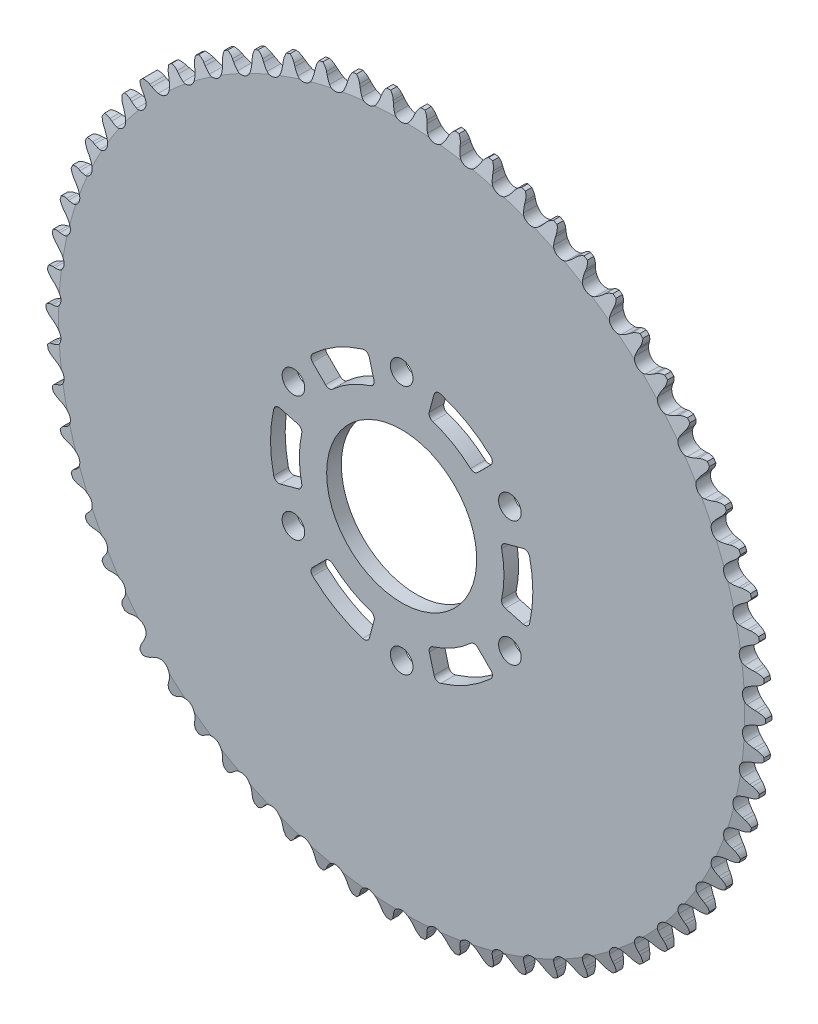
SolidWorks part; units mm, degrees
ref_plane "Front Plane" through (0, 0, 0) normal (0, 0, 1) x (1, 0, 0)
ref_plane "Top Plane" through (0, 0, 0) normal (0, 1, 0) x (1, 0, 0)
ref_plane "Right Plane" through (0, 0, 0) normal (1, 0, 0) x (0, 0, -1)
imported_body "Imported3"
sketch "Sketch1" plane through (0, 0, 0) normal (0, 0, -1) x (-1, 0, 0)
  line L0 (-4.9979, 18.8486) -> (-6.4214, 24.1612)
  line L1 (-17.6956, 17.6597) -> (-13.8065, 13.7706)
  arc A0 (-6.4214, 24.1612) -> (-17.6956, 17.6597) centre (0, 0) ccw
  arc A1 (-13.8065, 13.7706) -> (-4.9979, 18.8486) centre (0, 0) cw
extrude "Cut-Extrude1" cut sketch "Sketch1" against normal through all
sketch "Sketch2" plane through (0, 0, 0) normal (0, 0, -1) x (-1, 0, 0)
  line L0 (-18.8223, 5.096) -> (-24.1349, 6.5195)
  line L1 (-24.1416, -6.495) -> (-18.829, -5.0715)
  arc A0 (-24.1349, 6.5195) -> (-24.1416, -6.495) centre (0, 0) ccw
  arc A1 (-18.829, -5.0715) -> (-18.8223, 5.096) centre (0, 0) cw
extrude "Cut-Extrude2" cut sketch "Sketch2" against normal through all
sketch "Sketch3" plane through (0, 0, 0) normal (0, 0, -1) x (-1, 0, 0)
  line L0 (-13.8245, -13.7526) -> (-17.7136, -17.6417)
  line L1 (-6.4459, -24.1547) -> (-5.0224, -18.8421)
  arc A0 (-17.7136, -17.6417) -> (-6.4459, -24.1547) centre (0, 0) ccw
  arc A1 (-5.0224, -18.8421) -> (-13.8245, -13.7526) centre (0, 0) cw
extrude "Cut-Extrude3" cut sketch "Sketch3" against normal through all
sketch "Sketch4" plane through (0, 0, 0) normal (0, 0, -1) x (-1, 0, 0)
  line L0 (4.9979, -18.8486) -> (6.4214, -24.1612)
  line L1 (17.6956, -17.6597) -> (13.8065, -13.7706)
  arc A0 (6.4214, -24.1612) -> (17.6956, -17.6597) centre (0, 0) ccw
  arc A1 (13.8065, -13.7706) -> (4.9979, -18.8486) centre (0, 0) cw
extrude "Cut-Extrude4" cut sketch "Sketch4" against normal through all
sketch "Sketch5" plane through (0, 0, 0) normal (0, 0, -1) x (-1, 0, 0)
  line L0 (18.8223, -5.096) -> (24.1349, -6.5195)
  line L1 (24.1416, 6.495) -> (18.829, 5.0715)
  arc A0 (24.1349, -6.5195) -> (24.1416, 6.495) centre (0, 0) ccw
  arc A1 (18.829, 5.0715) -> (18.8223, -5.096) centre (0, 0) cw
extrude "Cut-Extrude5" cut sketch "Sketch5" against normal through all
sketch "Sketch6" plane through (0, 0, 2.794) normal (0, 0, 1) x (1, 0, 0)
  line L0 (-5.0224, 18.8421) -> (-6.4459, 24.1547)
  line L1 (-17.7136, 17.6417) -> (-13.8245, 13.7526)
  arc A0 (-13.8245, 13.7526) -> (-5.0224, 18.8421) centre (0, 0) cw
  arc A1 (-6.4459, 24.1547) -> (-17.7136, 17.6417) centre (0, 0) ccw
extrude "Cut-Extrude6" cut sketch "Sketch6" against normal through all
hole_wizard "M4 Clearance Hole1" positions "Sketch8" profile "Sketch7" hole size "M4" standard "ANSI Metric"
sketch "Sketch8" plane through (0, 0, 0) normal (0, 0, -1) x (-1, 0, 0)
  point P0 (20.6222, 11.9063)
  point P1 (20.6222, -11.9062)
  point P2 (0, -23.8125)
  point P3 (-20.6222, -11.9063)
  point P4 (-20.6222, 11.9062)
  point P5 (0, 23.8125)
sketch "Sketch7" plane through (-20.6222, 11.9063, 0) normal (1, 0, 0) x (0, 1, 0)
  line L0 (0, 0) -> (0, 2.794)
  line L1 (0, 2.794) -> (2.1526, 2.794)
  line L2 (2.1526, 2.794) -> (2.1526, 0)
  line L5 (2.1526, 0) -> (0, 0)
  line L11 (0, -6.35) -> (0, 107.95) construction
  dimension "Thru Hole Dia." = 4.3053
  dimension "Thru Hole Depth" = 2.794
hole_wizard "M25 Clearance Hole1" positions "Sketch10" profile "Sketch9" hole size "M25" standard "ANSI Metric"
sketch "Sketch10" plane through (0, 0, 0) normal (0, 0, -1) x (-1, 0, 0)
  point P0 (0, 0)
sketch "Sketch9" plane through (0, 0, 0) normal (1, 0, 0) x (0, 1, 0)
  line L0 (0, 0) -> (0, 2.794)
  line L1 (0, 2.794) -> (14.3, 2.794)
  line L2 (14.3, 2.794) -> (14.3, 0)
  line L5 (14.3, 0) -> (0, 0)
  line L11 (0, -6.35) -> (0, 107.95) construction
  dimension "Thru Hole Dia." = 28.6
  dimension "Thru Hole Depth" = 2.794
fillet "Fillet1" radius 1 24 edges at (13.8245, -13.7526, 1.397) (4.9979, 18.8486, 1.397) (24.1349, 6.5195, 1.397) (-6.4459, 24.1547, 1.397) (5.0224, -18.8421, 1.397) (-5.0224, 18.8421, 1.397) (18.829, -5.0715, 1.397) (-17.7136, 17.6417, 1.397) (13.8065, 13.7706, 1.397) (-13.8245, 13.7526, 1.397) (6.4459, -24.1547, 1.397) (-24.1416, 6.495, 1.397) (17.7136, -17.6417, 1.397) (-18.829, 5.0715, 1.397) (24.1416, -6.495, 1.397) (-24.1349, -6.5195, 1.397) (18.8223, 5.096, 1.397) (-18.8223, -5.096, 1.397) (17.6956, 17.6597, 1.397) (-17.6956, -17.6597, 1.397) (6.4214, 24.1612, 1.397) (-6.4214, -24.1612, 1.397) (-4.9979, -18.8486, 1.397) (-13.8065, -13.7706, 1.397)
